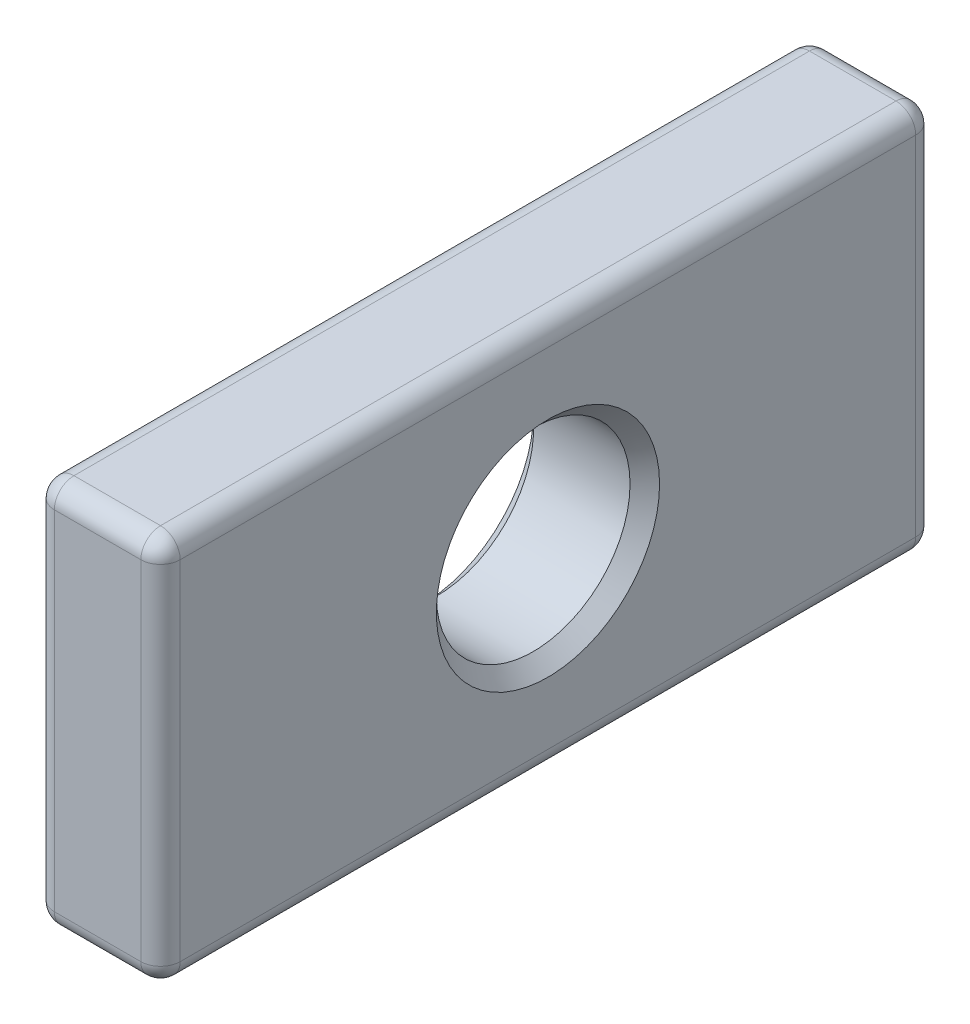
SolidWorks part; units mm, degrees
ref_plane "Front Plane" through (0, 0, 0) normal (0, 0, 1) x (1, 0, 0)
ref_plane "Top Plane" through (0, 0, 0) normal (0, 1, 0) x (1, 0, 0)
ref_plane "Right Plane" through (0, 0, 0) normal (1, 0, 0) x (0, 0, -1)
sketch "Sketch1" plane through (0, 0, 0) normal (1, 0, 0) x (0, 0, -1)
  line L1 (-20, 10) -> (20, 10)
  line L2 (-20, 10) -> (-20, -10)
  line L3 (-20, -10) -> (20, -10)
  line L4 (20, 10) -> (20, -10)
  line L5 (-20, 10) -> (20, -10) construction
  line L6 (-20, -10) -> (20, 10) construction
  circle A0 centre (0, 0) radius 5
  point P0 (0, 0)
  dimension "D3" = 10
  dimension "D1" = 20
  dimension "D2" = 40
extrude "Boss-Extrude1" add sketch "Sketch1" along normal mid plane 6.5
fillet "Fillet1" radius 1.016 12 edges at (0, -10, -20) (0, 10, -20) (-3.25, 10, 0) (-3.25, -10, 0) (-3.25, 0, -20) (0, 10, 20) (0, -10, 20) (-3.25, 0, 20) (3.25, -10, 0) (3.25, 0, 20) (3.25, 10, 0) (3.25, 0, -20)
chamfer "Chamfer1" distance 0.762 angle 45 2 edges at (-3.25, 0, -5) (3.25, 0, -5)
